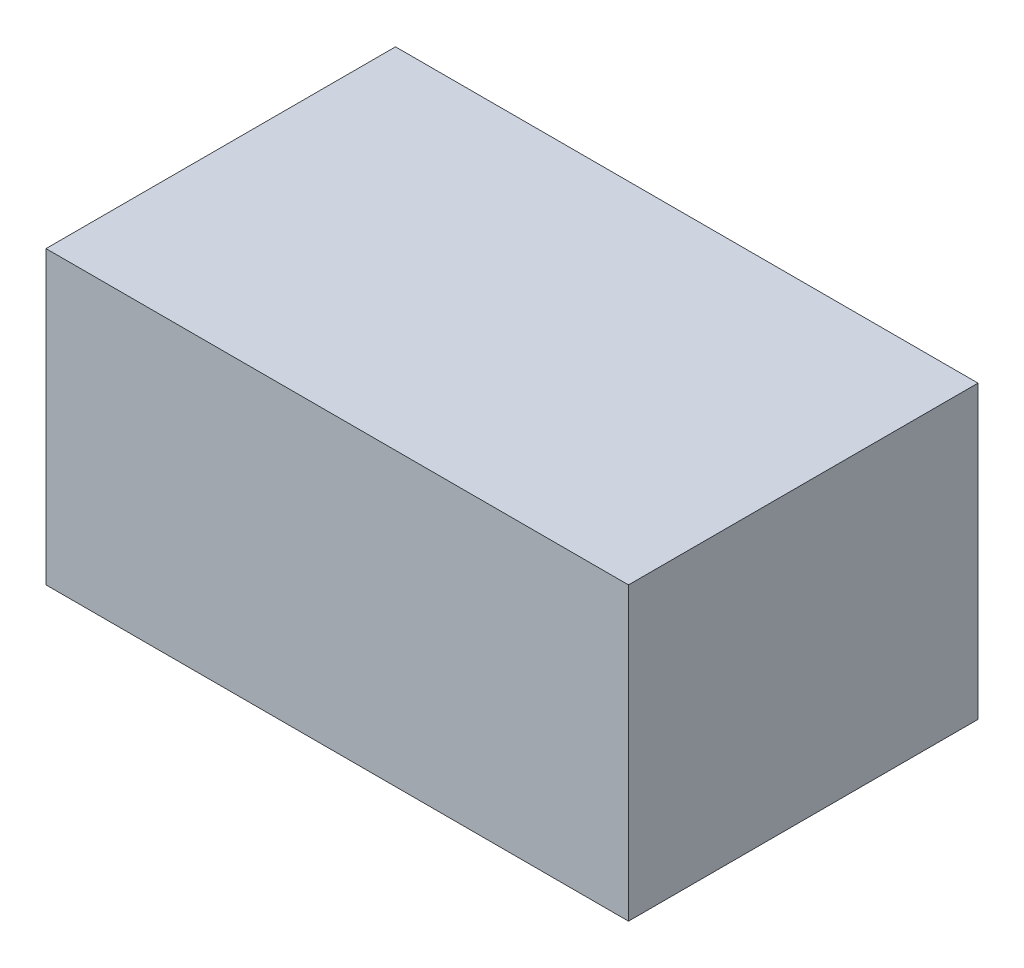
SolidWorks part; units mm, degrees
ref_plane "Ebene vorne" through (0, 0, 0) normal (0, 0, 1) x (1, 0, 0)
ref_plane "Ebene oben" through (0, 0, 0) normal (0, 1, 0) x (1, 0, 0)
ref_plane "Ebene rechts" through (0, 0, 0) normal (1, 0, 0) x (0, 0, -1)
sketch "Skizze1" plane through (0, 0, 0) normal (0, 1, 0) x (1, 0, 0)
  line L1 (0, 0) -> (100, 0)
  line L2 (0, 0) -> (0, -60)
  line L3 (0, -60) -> (100, -60)
  line L4 (100, 0) -> (100, -60)
  dimension "D1" = 100
  dimension "D2" = 60
extrude "Linear austragen1" add sketch "Skizze1" along normal blind 50
hole_wizard "M12 Gewindebohrung1" positions "Skizze2" profile "Skizze3" tap size "M12" standard "DIN"
sketch "Skizze2" plane through (0, 0, 0) normal (0, -1, 0) x (1, 0, 0)
  point P0 (75, 30)
  point P1 (25, 30)
sketch "Skizze3" plane through (75, 0, 30) normal (1, 0, 0) x (0, 0, -1)
  line L0 (0, 0) -> (0, 35.8144)
  line L1 (0, 35.8144) -> (5.1, 32.75)
  line L2 (5.1, 32.75) -> (5.1, 0)
  line L5 (5.1, 0) -> (0, 0)
  line L10 (0, 35.8144) -> (-5.1, 32.75) construction
  line L11 (0, -6.35) -> (0, 107.95) construction
  dimension "Bohrerdurchmesser" = 10.2
  dimension "Bohrungstiefe" = 32.75
  dimension "Spitzenwinkel" = 118
